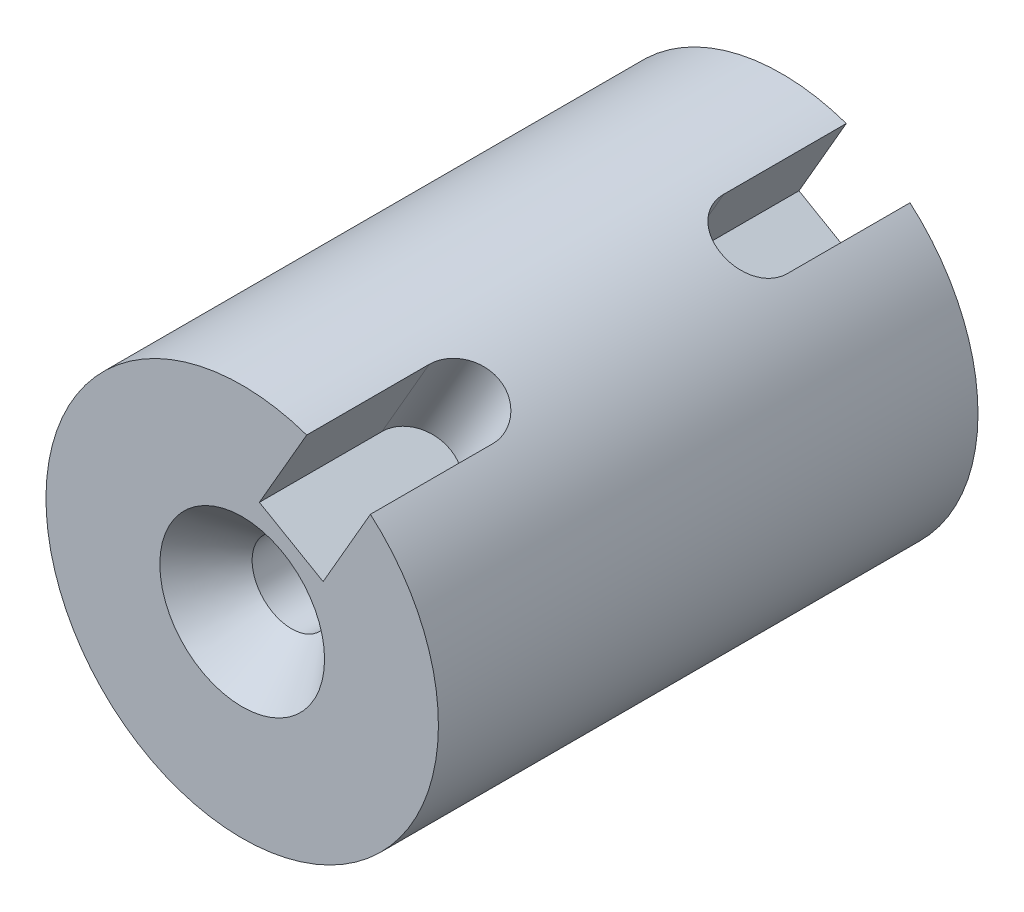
SolidWorks part; units mm, degrees
ref_plane "Front Plane" through (0, 0, 0) normal (0, 0, 1) x (1, 0, 0)
ref_plane "Top Plane" through (0, 0, 0) normal (0, 1, 0) x (1, 0, 0)
ref_plane "Right Plane" through (0, 0, 0) normal (1, 0, 0) x (0, 0, -1)
sketch "Sketch1" plane through (0, 0, 0) normal (0, 0, 1) x (1, 0, 0)
  line L0 (0, 0) -> (0, 12.7) construction
  line L1 (0, 0) -> (6.35, 10.9985) construction
  circle A0 centre (0, 0) radius 12.7
  dimension "D1" = 25.4
  dimension "D2" = 30
extrude "Extrude1" add sketch "Sketch1" along normal blind 12.7
sketch "Sketch6" plane through (0, 0, 12.7) normal (0, 0, 1) x (1, 0, 0)
  circle A1 centre (0, 0) radius 12.7 construction
  circle A2 centre (0, 0) radius 12.7
extrude "Boss-Extrude1" add sketch "Sketch6" along normal blind 11.1125
hole_wizard "CSK for #10 Flat Head Machine Screw1" positions "Sketch3" profile "Sketch2" countersink size "#10" standard "Ansi Inch"
sketch "Sketch3" plane through (-2.2871, 3.9963, 23.8125) normal (0, 0, 1) x (1, 0, 0)
  point P0 (2.2871, -3.9963)
sketch "Sketch2" plane through (0, 0, 23.8125) normal (1, 0, 0) x (0, -1, 0)
  line L0 (0, 0) -> (0, 23.8125)
  line L1 (0, 23.8125) -> (2.5527, 23.8125)
  line L2 (2.5527, 23.8125) -> (2.5527, 3.1962)
  line L3 (2.5527, 3.1962) -> (5.3311, 0)
  line L5 (5.3311, 0) -> (0, 0)
  line L6 (-2.5527, 3.1962) -> (-5.3311, 0) construction
  line L11 (0, -6.35) -> (0, 107.95) construction
  dimension "Thru Hole Dia." = 5.1054
  dimension "Thru Hole Depth" = 23.8125
  dimension "Near C'Sink Dia." = 10.6622
  dimension "Near C'Sink Angle" = 82
sketch "Sketch4" plane through (0, 0, 0) normal (0, 0, -1) x (-1, 0, 0)
  circle A0 centre (0, 0) radius 4.7625
  dimension "D1" = 9.525
extrude "Cut-Extrude1" cut sketch "Sketch4" against normal blind 6.35
ref_plane "Plane1" through (6.35, 10.9985, 0) normal (0.5, 0.866, 0) x (-0.866, 0.5, 0)
sketch "Sketch7" plane through (0, 0, 0) normal (0, 0, -1) x (-1, 0, 0)
  circle A0 centre (0, 0) radius 12.7
  circle A1 centre (0, 0) radius 4.7625
  circle A2 centre (0, 0) radius 12.7 construction
  circle A3 centre (0, 0) radius 4.7625 construction
extrude "Boss-Extrude2" add sketch "Sketch7" along normal blind 11.1125
sketch "Sketch8" plane through (6.35, 10.9985, 0) normal (0.5, 0.866, 0) x (-0.866, 0.5, 0)
  line L0 (-2.3813, 15.875) -> (-2.3813, 23.8125)
  line L1 (12.7, 23.8125) -> (-12.7, 23.8125) construction
  line L2 (-2.3813, 23.8125) -> (2.3813, 23.8125)
  line L3 (2.3813, 23.8125) -> (2.3813, 15.875)
  line L4 (-2.3813, -11.1125) -> (-2.3813, -3.175)
  line L5 (2.3813, -3.175) -> (2.3813, -11.1125)
  line L6 (2.3813, -11.1125) -> (-2.3813, -11.1125)
  line L7 (-12.7, -11.1125) -> (12.7, -11.1125) construction
  arc A0 (-2.3813, 15.875) -> (2.3813, 15.875) centre (0, 15.875) ccw
  arc A1 (2.3813, -3.175) -> (-2.3813, -3.175) centre (0, -3.175) ccw
  dimension "D1" = 4.7625
  dimension "D2" = 7.9375
  dimension "D3" = 7.9375
extrude "Cut-Extrude2" cut sketch "Sketch8" against normal blind 6.35
